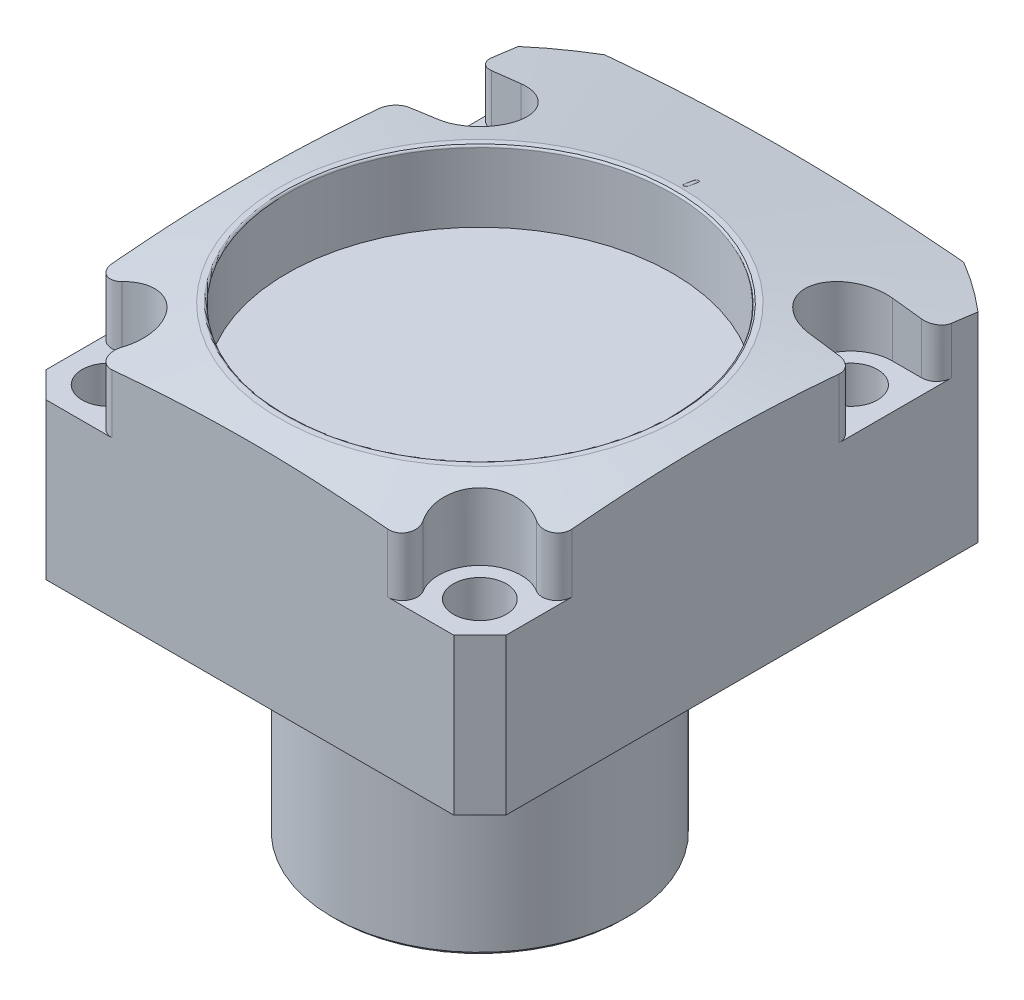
SolidWorks part; units mm, degrees
ref_plane "Front Plane" through (0, 0, 0) normal (0, 0, 1) x (1, 0, 0)
ref_plane "Top Plane" through (0, 0, 0) normal (0, 1, 0) x (1, 0, 0)
ref_plane "Right Plane" through (0, 0, 0) normal (1, 0, 0) x (0, 0, -1)
sketch "Sketch6" plane through (0, 0, 0) normal (0, 0, 1) x (1, 0, 0)
  line L0 (0, -8.9689) -> (0, 71.3762) construction
  line L1 (26.0096, 30.5562) -> (27, 30.5562)
  line L2 (27, 30.5562) -> (47.625, 26.9195)
  line L3 (47.625, 26.9195) -> (47.625, 0)
  line L4 (47.625, 0) -> (19.885, 0)
  line L5 (19.885, 0) -> (19.885, -31.6992)
  line L6 (19.885, -31.6992) -> (0, -31.6992)
  line L7 (0, -31.6992) -> (0, 21.0058)
  line L8 (26.0096, 30.5562) -> (26.0096, 21.0058)
  line L9 (26.0096, 21.0058) -> (0, 21.0058)
  dimension "D1" = 39.77
  dimension "D2" = 30.5562
  dimension "D3" = 31.6992
  dimension "D4" = 95.25
  dimension "D5" = 10
  dimension "D6" = 54
  dimension "D7" = 9.5504
  dimension "D8" = 52.0192
  dimension "D9" = 62.2554
  dimension "D10" = 3.6367
revolve "Revolve3" add sketch "Sketch6" angle 360 about L0
fillet "Fillet7" radius 0.254 1 edges at (0, 30.5562, -26.0096)
sketch "Sketch7" plane through (0, 0, 0) normal (0, -1, 0) x (1, 0, 0)
  line L0 (0, 0) -> (0, -52.3237) construction
  line L1 (-30.9944, 30.9944) -> (30.9943, 30.9944)
  line L2 (-30.9944, 30.9944) -> (-30.9944, -41.0146)
  line L3 (-30.9944, -41.0146) -> (30.9944, -41.0146)
  line L4 (30.9943, 30.9944) -> (30.9944, -41.0146)
  dimension "D1" = 61.9887
  dimension "D2" = 72.009
  dimension "D3" = 30.9944
  dimension "D4" = 30.9944
  dimension "D5" = 41.0146
extrude "Cut-Extrude5" cut sketch "Sketch7" against normal through all flip side to cut
sketch "Sketch8" plane through (0, 0, 0) normal (0, -1, 0) x (1, 0, 0)
  circle A0 centre (-25.019, 25.019) radius 3.5687
  dimension "D1" = 7.1374
  dimension "D2" = 25.019
  dimension "D3" = 25.019
extrude "Cut-Extrude6" cut sketch "Sketch8" against normal through all
pattern_circular "CirPattern2" count 4 over 360 about axis through (0, 0, 0) along (0, 1, 0) of "Cut-Extrude6"
chamfer "Chamfer1" distance 3.5052 angle 45 2 edges at (-30.9944, 13.7941, 30.9944) (30.9943, 13.7941, 30.9944)
sketch "Sketch9" plane through (0, 30.5562, 0) normal (0, 1, 0) x (1, 0, 0)
  line L0 (-30.9944, -27.4891) -> (-27.4892, -30.9944) construction
  line L1 (-27.4892, -30.9944) -> (27.4891, -30.9944) construction
  line L2 (30.9944, 30.5816) -> (30.9944, 19.4564)
  line L3 (-30.9944, -27.4891) -> (-27.4892, -30.9944)
  line L4 (30.9944, 19.4564) -> (25.019, 19.4564)
  line L5 (25.019, 30.5816) -> (30.9944, 30.5816)
  line L6 (-25.019, 30.5816) -> (-30.9944, 30.5816)
  line L7 (-30.9944, 36.1592) -> (-30.9944, -27.4891) construction
  line L8 (-30.9944, 19.4564) -> (-25.019, 19.4564)
  line L9 (-30.9944, 30.5816) -> (-30.9944, 19.4564)
  line L10 (-27.4892, -30.9944) -> (-23.1276, -30.9944)
  line L11 (0, 0) -> (0, 26.6366) construction
  line L13 (-30.9944, -23.1276) -> (-28.9524, -21.0856)
  line L14 (-21.0856, -28.9524) -> (-23.1276, -30.9944)
  line L15 (-30.9944, -23.1276) -> (-30.9944, -27.4891)
  line L16 (30.9944, -23.1276) -> (30.9944, -27.4891)
  line L17 (21.0856, -28.9524) -> (23.1276, -30.9944)
  line L18 (30.9944, -23.1276) -> (28.9524, -21.0856)
  line L19 (27.4891, -30.9944) -> (23.1276, -30.9944)
  line L20 (30.9944, -27.4891) -> (27.4891, -30.9944)
  arc A0 (-21.0856, -28.9524) -> (-28.9524, -21.0856) centre (-25.019, -25.019) ccw
  arc A1 (-25.019, 19.4564) -> (-25.019, 30.5816) centre (-25.019, 25.019) ccw
  arc A2 (21.0856, -28.9524) -> (28.9524, -21.0856) centre (25.019, -25.019) cw
  arc A3 (25.019, 19.4564) -> (25.019, 30.5816) centre (25.019, 25.019) cw
  dimension "D1" = 11.1252
extrude "Cut-Extrude7" cut sketch "Sketch9" against normal offset from surface (9.5504 mm away) 21.0058
fillet "Fillet4" radius 2.0066 8 edges at (-30.9944, 24.9351, -19.4564) (30.9944, 24.3226, -30.5816) (30.9944, 24.9351, -19.4564) (30.9944, 24.7519, 23.1276) (23.1276, 24.7519, 30.9944) (-23.1276, 24.7519, 30.9944) (-30.9944, 24.7519, 23.1276) (-30.9944, 24.3226, -30.5816)
fillet "Fillet5" radius 0.4013 1 edges at (0, 0, -19.885)
chamfer "Chamfer2" distance 0.5004 angle 45 1 edges at (0, -31.6992, -19.885)
ref_plane "Plane1" through (0, 17.018, 0) normal (0, -1, 0) x (1, 0, 0)
sketch "Sketch11" plane through (0, 17.018, 0) normal (0, -1, 0) x (1, 0, 0)
  line L0 (-14, -4.7006) -> (-14, -58.3255) construction
  line L1 (-24.2062, -41.0146) -> (24.2062, -41.0146) construction
  line L2 (-20.1849, -40.7646) -> (-19.6396, -38.1992)
  line L3 (-19.6396, -38.1992) -> (-18.9784, -37.538)
  line L10 (-14, -41.0146) -> (-24.4775, -41.0146)
  line L11 (-14, -26.0326) -> (-14, -41.0146)
  line L12 (-18.9784, -26.0326) -> (-14, -26.0326)
  line L13 (-18.9784, -37.538) -> (-18.9784, -26.0326)
  line L15 (-24.4775, -40.7646) -> (-20.1849, -40.7646)
  line L16 (-24.4775, -41.0146) -> (-24.4775, -40.7646)
  dimension "D1" = 14
  dimension "D2" = 0.25
  dimension "D3" = 14.732
  dimension "D4" = 9.9568
  dimension "D5" = 20.955
  dimension "D6" = 12
  dimension "D7" = 45
  dimension "D8" = 2.5654
  dimension "D9" = 12.3698
revolve "Cut-Revolve5" cut sketch "Sketch11" angle 360 about L0
ref_plane "Plane2" through (0, 0, -32.7406) normal (0, 0, 1) x (1, 0, 0)
sketch "Sketch13" plane through (0, 0, -32.7406) normal (0, 0, 1) x (1, 0, 0)
  line L0 (-17.4544, 17.7546) -> (-17.4544, 5.5009)
  line L1 (-18.572, 2.7432) -> (-18.1293, 4.826)
  line L2 (-18.572, 2.7432) -> (-19.4991, 2.7432)
  line L3 (-19.4991, 2.7432) -> (-19.4991, 0)
  line L4 (-20.2863, 0) -> (20.2863, 0) construction
  line L5 (-19.4991, 0) -> (-14, 0)
  line L6 (-14, 0) -> (-14, 17.7546)
  line L7 (-14, 17.7546) -> (-17.4544, 17.7546)
  line L8 (-14, 15.2099) -> (-14, -4.3918) construction
  line L9 (-18.1293, 4.826) -> (-17.4544, 5.5009)
  line L10 (-18.572, 2.7432) -> (-14, 2.7432) construction
  dimension "D1" = 14
  dimension "D2" = 6.9088
  dimension "D3" = 15.0114
  dimension "D4" = 2.7432
  dimension "D5" = 10.9982
  dimension "D6" = 2.0828
  dimension "D7" = 12
  dimension "D8" = 45
  dimension "D9" = 9.144
revolve "Cut-Revolve6" cut sketch "Sketch13" angle 360 about L8
sketch "Sketch1" plane through (-3.5242, 5.6324, -32.7406) normal (0, 0, 1) x (1, 0, 0)
  line L0 (-10.4758, 0) -> (-10.4758, 50000) construction
  line L1 (-8.8883, 2.521) -> (-6.6023, 2.521)
  line L2 (-6.6023, 2.521) -> (-6.6023, -0.3754)
  line L3 (-6.5642, -2.8892) -> (50000, -2.8892) construction
  line L4 (-7.4786, -1.289) -> (-7.4786, -1.9748)
  line L5 (-6.5642, -2.8892) -> (-5.0148, -2.8892)
  line L6 (-5.0148, -2.8892) -> (-5.0148, -4.3116)
  line L7 (-5.0148, -4.3116) -> (-5.6928, -4.3116)
  line L8 (-7.8088, -4.3116) -> (-7.8088, -5.4292)
  line L9 (-7.8088, -5.4292) -> (-8.8883, -5.4292)
  line L10 (-8.8883, -5.4292) -> (-8.8883, 2.521)
  line L11 (-1000, -2.8892) -> (-8.8883, -2.8892) construction
  line L12 (-6.1147, -4.3116) -> (-7.8088, -4.3116)
  arc A0 (-6.6023, -0.3754) -> (-7.4786, -1.289) centre (-6.5642, -1.289) ccw
  arc A1 (-7.4786, -1.9748) -> (-6.5642, -2.8892) centre (-6.5642, -1.9748) ccw
  arc A2 (-6.1147, -4.3116) -> (-5.6928, -4.3116) centre (-5.9038, -5.1752) ccw
  dimension "D8" = 1.6002
  dimension "D9" = 0.9144
  dimension "D10" = 7.9502
  dimension "D11" = 1.778
  dimension "D1" = 7.747
  dimension "D2" = 5.9944
  dimension "D3" = 10.922
  dimension "D4" = 5.334
  dimension "D5" = 3.175
  dimension "D6" = 1.4224
  dimension "D7" = 2.54
  dimension "D12" = 0.8636
revolve "Revolve1" add sketch "Sketch1" angle 360 about L0
sketch "Sketch2" plane through (-14, 0.2032, -32.7406) normal (0, -1, 0) x (0, 0, 1)
  line L0 (0, 0) -> (0, 50000) construction
  line L1 (0, 1.8331) -> (1.5875, 0.9165)
  line L2 (1.5875, 0.9165) -> (1.5875, -0.9165)
  line L3 (1.5875, -0.9165) -> (0, -1.8331)
  line L4 (0, -1.8331) -> (-1.5875, -0.9165)
  line L5 (-1.5875, -0.9165) -> (-1.5875, 0.9165)
  line L6 (-1.5875, 0.9165) -> (0, 1.8331)
  circle A0 centre (0, 0) radius 1.5875 construction
  dimension "D1" = 3.175
extrude "Cut-Extrude1" cut sketch "Sketch2" against normal up to surface (7.9502 mm away)
other "PORT_ADTAPTER<1>"
mirror "Mirror4" about plane through (0, 0, 0) normal (1, 0, 0) of "Revolve1", "Cut-Extrude1", "Cut-Revolve6", "Cut-Revolve5"
sketch "Sketch17" plane through (0, 0, 0) normal (1, 0, 0) x (0, 0, -1)
  line L0 (26.7557, 31.371) -> (29.9871, 30.8012) construction
  line L1 (41.0146, 28.085) -> (27, 30.5562) construction
  line L2 (27.5003, 30.468) -> (29.4764, 30.1195) construction
  line L3 (27.8786, 31.173) -> (29.3621, 30.9114) construction
  line L5 (27.7396, 30.3851) -> (29.2231, 30.1235)
  line L6 (27.0906, 31.3119) -> (30.15, 30.7725)
  arc A0 (27.0906, 31.3119) -> (27.7396, 30.3851) centre (27.8786, 31.173) ccw
  arc A1 (29.2231, 30.1235) -> (30.15, 30.7725) centre (29.3621, 30.9114) ccw
  dimension "D2" = 1.6002
  dimension "D1" = 0.76
  dimension "D3" = 2.0066
  dimension "D4" = 0.508
revolve "Cut-Revolve7" cut sketch "Sketch17" angle 360 about L0
equation "\"D3@Sketch8\"=\"D2@Sketch8\""
equation "\"D3@Sketch7\"=\"D4@Sketch7\""
